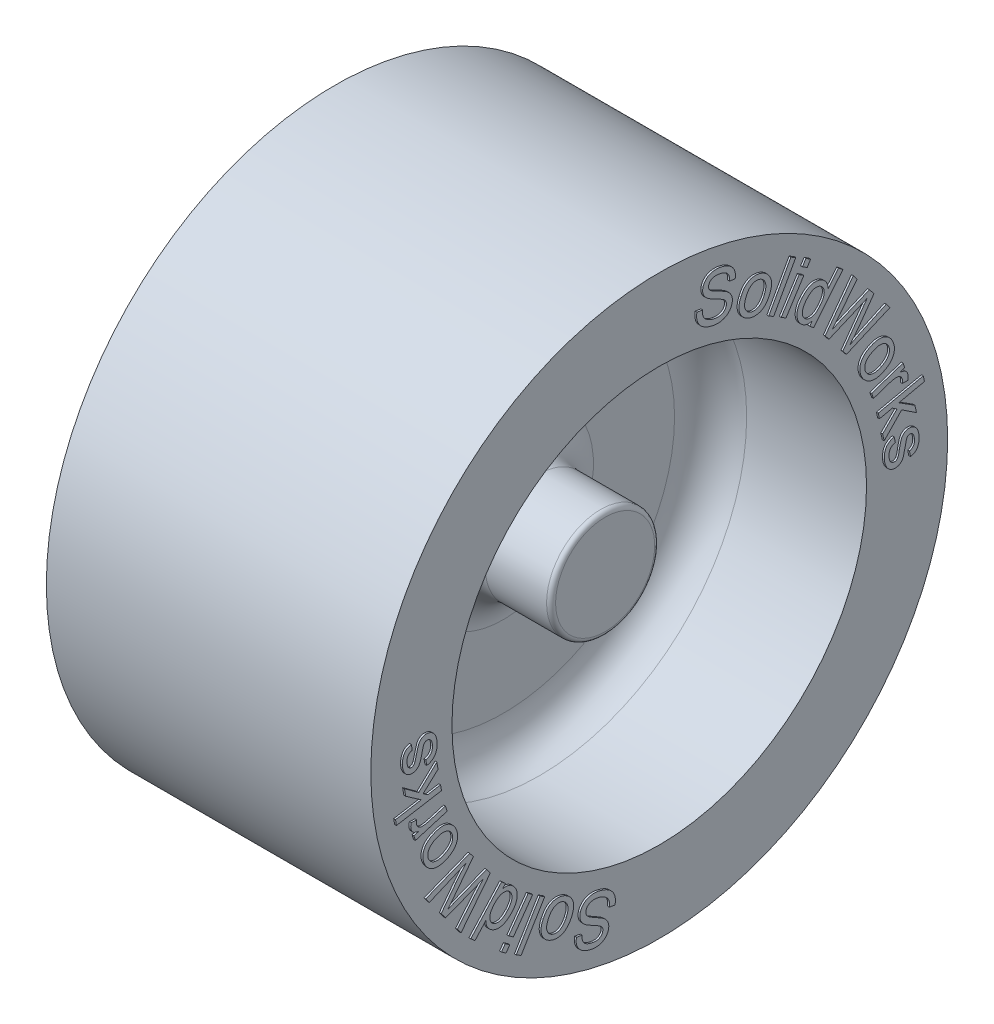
SolidWorks part; units mm, degrees
ref_plane "Front Plane" through (0, 0, 0) normal (0, 0, 1) x (1, 0, 0)
ref_plane "Top Plane" through (0, 0, 0) normal (0, 1, 0) x (1, 0, 0)
ref_plane "Right Plane" through (0, 0, 0) normal (1, 0, 0) x (0, 0, -1)
sketch "Sketch1" plane through (0, 0, 0) normal (0, 0, 1) x (1, 0, 0)
  line L0 (0, 0) -> (14.6475, 0) construction
  line L1 (14.6475, 26.8961) -> (14.6475, -4.8961) construction
  line L2 (14.6475, 11.5) -> (14.6475, 16)
  line L3 (-3.3525, 16) -> (14.6475, 16)
  line L4 (14.6475, 11.5) -> (7.9975, 11.5)
  line L5 (0.3975, 4.5) -> (0.3975, 3.375)
  line L6 (0.1475, 3.125) -> (-4.3525, 3.125)
  line L7 (-4.3525, 3.125) -> (-4.3525, 0)
  line L8 (11.6475, 0) -> (-4.3525, 0)
  line L9 (4.3975, 13) -> (11.1475, 13)
  line L10 (11.1475, 13) -> (11.1475, 14.25)
  line L11 (2.3975, 11) -> (2.3975, 5)
  line L12 (2.1475, 4.75) -> (0.6475, 4.75)
  line L13 (11.3975, 3) -> (7.9975, 3)
  line L14 (5.9975, 5) -> (5.9975, 9.5)
  line L15 (11.6475, 2.75) -> (11.6475, 0)
  line L16 (11.1475, 14.25) -> (-3.3525, 14.25)
  line L17 (-3.3525, 14.25) -> (-3.3525, 16)
  arc A1 (5.9975, 5) -> (7.9975, 3) centre (7.9975, 5) ccw
  arc A2 (5.9975, 9.5) -> (7.9975, 11.5) centre (7.9975, 9.5) cw
  arc A3 (11.3975, 3) -> (11.6475, 2.75) centre (11.3975, 2.75) cw
  arc A4 (2.3975, 5) -> (2.1475, 4.75) centre (2.1475, 5) cw
  arc A5 (0.3975, 3.375) -> (0.1475, 3.125) centre (0.1475, 3.375) cw
  arc A6 (0.3975, 4.5) -> (0.6475, 4.75) centre (0.6475, 4.5) cw
  arc A7 (2.3975, 11) -> (4.3975, 13) centre (4.3975, 11) cw
  point P26 (2.3975, 13)
  point P32 (11.6475, 3)
  point P36 (2.3975, 4.75)
  point P40 (0.3975, 3.125)
  point P43 (0.3975, 4.75)
  dimension "D4" = 4.75
  dimension "D8" = 2
  dimension "D1" = 3.125
  dimension "D10" = 18
  dimension "D11" = 1.75
  dimension "D5" = 4.75
  dimension "D9" = 2
  dimension "D2" = 16
  dimension "D3" = 3
  dimension "D6" = 2
  dimension "D7" = 8.25
  dimension "D12" = 14.5
  dimension "D13" = 16
  dimension "D16" = 19
revolve "Revolve1" add sketch "Sketch1" angle 360 about L0
sketch "Sketch2" plane through (-4.3525, 0, 0) normal (-1, 0, 0) x (0, 0, 1)
  circle A0 centre (0, 0) radius 1.55
extrude "Cut-Extrude1" cut sketch "Sketch2" against normal blind 15
sketch "Sketch3" plane through (14.6475, 0, 0) normal (1, 0, 0) x (0, 0, -1)
  circle A0 centre (0, 0) radius 12.5 construction
  text T0 "     SolidWorks                     SolidWorks" font "Arial" height in points 10
  dimension "D1" = 25
extrude "Boss-Extrude1" add sketch "Sketch3" along normal blind 0.1
